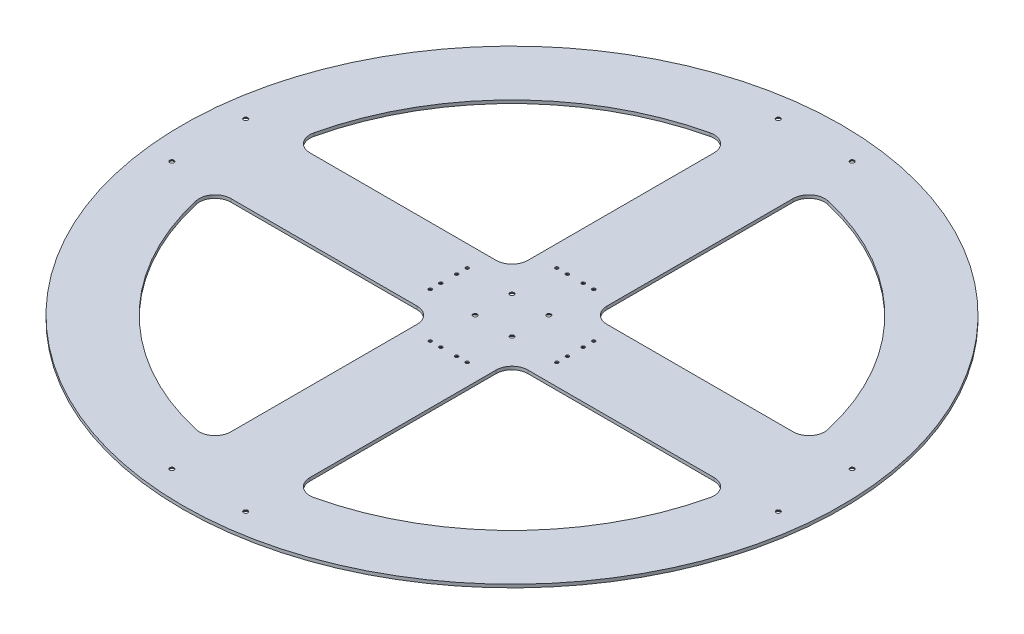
SolidWorks part; units mm, degrees
ref_plane "Plan de face" through (0, 0, 0) normal (0, 0, 1) x (1, 0, 0)
ref_plane "Plan de dessus" through (0, 0, 0) normal (0, 1, 0) x (1, 0, 0)
ref_plane "Plan de droite" through (0, 0, 0) normal (1, 0, 0) x (0, 0, -1)
sketch "Esquisse1" plane through (0, 0, 0) normal (0, 1, 0) x (1, 0, 0)
  line L0 (0, 350) -> (0, -500) construction
  line L1 (350, 0) -> (-350, 0) construction
  line L2 (-75, 494.343) -> (-75, 75)
  line L3 (494.343, 75) -> (75, 75)
  line L4 (75, 494.343) -> (75, 75)
  line L5 (494.343, -75) -> (75, -75)
  line L6 (-75, -75) -> (-75, -494.343)
  line L7 (-75, -75) -> (-494.343, -75)
  line L8 (-75, 350) -> (-75, -500) construction
  line L9 (350, 75) -> (-350, 75) construction
  line L10 (350, -75) -> (-350, -75) construction
  line L11 (75, -75) -> (75, -494.343)
  line L12 (-75, 75) -> (-494.343, 75)
  line L13 (75, 350) -> (75, -500) construction
  circle A0 centre (0, 0) radius 625
  arc A1 (-494.343, -75) -> (-75, -494.343) centre (0, 0) ccw
  arc A2 (-75, 494.343) -> (-494.343, 75) centre (0, 0) ccw
  arc A3 (494.343, 75) -> (75, 494.343) centre (0, 0) ccw
  arc A4 (75, -494.343) -> (494.343, -75) centre (0, 0) ccw
  dimension "D1" = 1250
  dimension "D2" = 1000
  dimension "D3" = 75
  dimension "D4" = 75
extrude "Boss.-Extru.1" add sketch "Esquisse1" along normal blind 6
fillet "Congé1" radius 30 12 edges at (75, 3, -494.343) (494.343, 3, -75) (75, 3, -75) (494.343, 3, 75) (75, 3, 75) (75, 3, 494.343) (-75, 3, 494.343) (-494.343, 3, 75) (-75, 3, 75) (-494.343, 3, -75) (-75, 3, -75) (-75, 3, -494.343)
sketch "Esquisse2" plane through (0, 6, 0) normal (0, 1, 0) x (1, 0, 0)
  line L1 (-35, -35) -> (35, -35) construction
  line L2 (-35, -35) -> (-35, 35) construction
  line L3 (-35, 35) -> (35, 35) construction
  line L4 (35, -35) -> (35, 35) construction
  line L5 (-35, -35) -> (35, 35) construction
  line L6 (-35, 35) -> (35, -35) construction
  circle A0 centre (-35, 35) radius 4
  circle A1 centre (-35, -35) radius 4
  circle A2 centre (35, -35) radius 4
  circle A3 centre (35, 35) radius 4
  point P0 (0, 0)
  dimension "D2" = 8
  dimension "D1" = 70
extrude "Enlèv. mat.-Extru.1" cut sketch "Esquisse2" against normal through all
chamfer "Chanfrein1" distance 5 angle 45 4 edges at (35, 0, -31) (-35, 0, -31) (-35, 0, 39) (35, 0, 39)
sketch "Esquisse3" plane through (0, 6, 0) normal (0, 1, 0) x (1, 0, 0)
  line L0 (0, 0) -> (0, 575) construction
  line L1 (70, 575) -> (-70, 575) construction
  circle A0 centre (-70, 575) radius 4.1
  circle A1 centre (70, 575) radius 4.1
  circle A2 centre (0, 0) radius 625 construction
  point P9 (0, 625)
  dimension "D3" = 8.2
  dimension "D1" = 140
  dimension "D2" = 50
extrude "Enlèv. mat.-Extru.2" cut sketch "Esquisse3" against normal through all
chamfer "Chanfrein2" distance 5 angle 45 2 edges at (-70, 0, -570.9) (70, 0, -570.9)
pattern_circular "Répétition circulaire1" count 4 every 90 about axis through (0, 0, 0) along (0, 1, 0) of "Enlèv. mat.-Extru.2", "Chanfrein2"
sketch "Esquisse4" plane through (0, 6, 0) normal (0, 1, 0) x (1, 0, 0)
  line L0 (0, 0) -> (120, 0) construction
  line L1 (-120, -120) -> (120, -120) construction
  line L2 (-120, -120) -> (-120, 120) construction
  line L3 (-120, 120) -> (120, 120) construction
  line L4 (120, -120) -> (120, 120) construction
  line L5 (-120, -120) -> (120, 120) construction
  line L6 (-120, 120) -> (120, -120) construction
  circle A0 centre (120, 35) radius 3.05
  circle A1 centre (120, 15) radius 3.05
  circle A2 centre (120, -15) radius 3.05
  circle A3 centre (120, -35) radius 3.05
  point P0 (0, 0)
  dimension "D2" = 6.1
  dimension "D4" = 20
  dimension "D5" = 15
  dimension "D6" = 20
  dimension "D1" = 240
  dimension "D3" = 15
extrude "Enlèv. mat.-Extru.3" cut sketch "Esquisse4" against normal through all
chamfer "Chanfrein3" distance 4 angle 45 4 edges at (120, 0, 38.05) (120, 0, 18.05) (120, 0, -11.95) (120, 0, -31.95)
pattern_circular "Répétition circulaire2" count 4 every 90 about axis through (0, 0, 0) along (0, 1, 0) of "Enlèv. mat.-Extru.3", "Chanfrein3"
